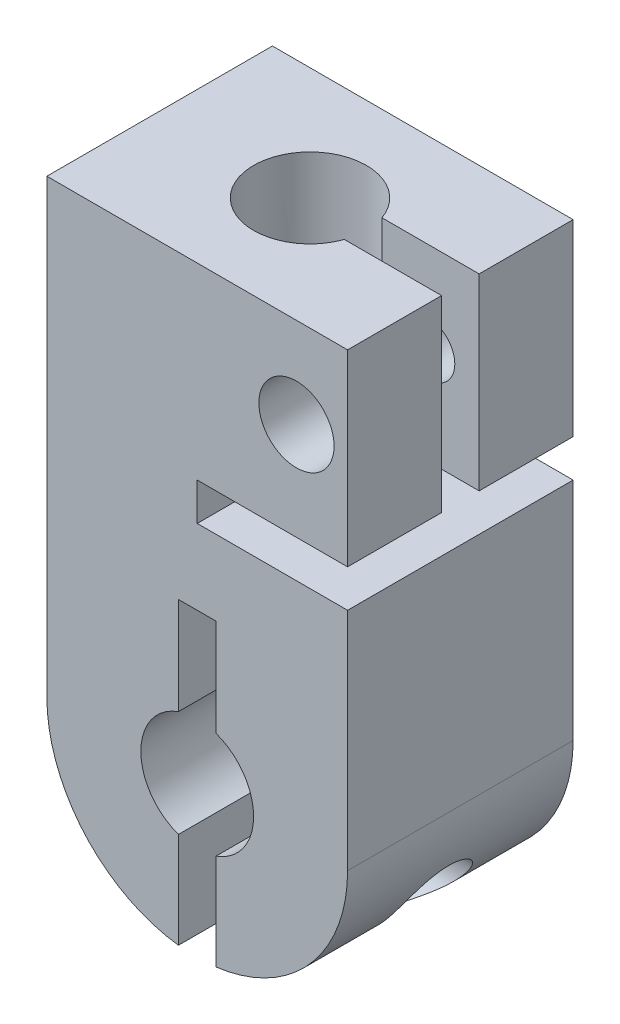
SolidWorks part; units mm, degrees
ref_plane "Front" through (0, 0, 0) normal (0, 0, 1) x (1, 0, 0)
ref_plane "Top" through (0, 0, 0) normal (0, 1, 0) x (1, 0, 0)
ref_plane "Right" through (0, 0, 0) normal (1, 0, 0) x (0, 0, -1)
sketch "Sketch1" plane through (0, 0, 0) normal (0, 0, 1) x (1, 0, 0)
  line L0 (-6.35, 0) -> (-6.35, 19.05)
  line L1 (-6.35, 19.05) -> (6.35, 19.05)
  line L2 (6.35, 19.05) -> (6.35, 0)
  line L3 (0, 1.0741) -> (0, 0) construction
  line L4 (0, 0) -> (0, 19.05) construction
  circle A0 centre (0, 0) radius 2.3813
  arc A1 (-6.35, 0) -> (6.35, 0) centre (0, 0) ccw
  dimension "D1" = 4.7625
  dimension "D3" = 19.05
  dimension "D2" = 12.7
extrude "Extrude1" add sketch "Sketch1" along normal blind 9.525
sketch "Sketch2" plane through (0, 0, 9.525) normal (0, 0, 1) x (1, 0, 0)
  line L0 (0, 0) -> (0, -7.0537) construction
  line L2 (-0.7938, 6.35) -> (0.7937, 6.35)
  line L3 (-0.7938, 6.35) -> (-0.7938, -10.2201)
  line L4 (-0.7938, -10.2201) -> (0.7938, -10.2201)
  line L5 (0.7937, 6.35) -> (0.7938, -10.2201)
  dimension "D1" = 1.5875
  dimension "D2" = 6.35
extrude "Cut-Extrude1" cut sketch "Sketch2" against normal through all
hole_wizard "#4-40 Tapped Hole1" positions "Sketch4" profile "Sketch3" tap size "#4-40" standard "Ansi Inch"
sketch "Sketch4" plane through (-0.7938, 0, 0) normal (1, 0, 0) x (0, 0, -1)
  line L0 (-4.7625, -6.3002) -> (-4.7625, 0.5343) construction
  line L1 (0, -6.3002) -> (-9.525, -6.3002) construction
  line L2 (-4.7625, 0.5343) -> (3.2388, 13.129) construction
  point P9 (-4.7625, -4.064)
  dimension "D2" = 4.064
sketch "Sketch3" plane through (-0.7938, -4.064, 4.7625) normal (0, 1, 0) x (0, 0, -1)
  line L0 (0, 0) -> (0, 5.5562)
  line L1 (0, 5.5562) -> (1.1303, 5.5562)
  line L2 (1.1303, 5.5562) -> (1.1303, 0)
  line L5 (1.1303, 0) -> (0, 0)
  line L11 (0, -6.35) -> (0, 107.95) construction
  dimension "Thru Tap Drill Dia." = 2.2606
  dimension "Thru Tap Drill Depth" = 5.5562
hole_wizard "#4 Clearance Hole1" positions "Sketch8" profile "Sketch7" hole size "#4" standard "Ansi Inch"
sketch "Sketch8" plane through (0.7937, 0, 0) normal (-1, 0, 0) x (0, 0, 1)
  point P0 (4.7625, -4.064)
sketch "Sketch7" plane through (0.7938, -4.064, 4.7625) normal (0, 1, 0) x (0, 0, 1)
  line L0 (0, 0) -> (0, 5.5563)
  line L1 (0, 5.5563) -> (1.6319, 5.5563)
  line L2 (1.6319, 5.5563) -> (1.6319, 0)
  line L5 (1.6319, 0) -> (0, 0)
  line L11 (0, -6.35) -> (0, 107.95) construction
  dimension "Thru Hole Dia." = 3.2639
  dimension "Thru Hole Depth" = 5.5563
sketch "Sketch11" plane through (0, 19.05, 0) normal (0, 1, 0) x (-1, 0, 0)
  line L0 (-6.35, 4.7625) -> (0, 4.7625) construction
  line L1 (-6.35, 9.525) -> (-6.35, 0) construction
  line L2 (0, 4.7625) -> (0, 0) construction
  line L4 (-6.35, 3.9688) -> (-2.2451, 3.9688)
  line L5 (-6.35, 3.9688) -> (-6.35, 5.5563)
  line L6 (-6.35, 5.5563) -> (-2.2451, 5.5563)
  arc A0 (-2.2451, 3.9688) -> (-2.2451, 5.5563) centre (0, 4.7625) ccw
  dimension "D2" = 4.7625
  dimension "D1" = 1.5875
extrude "Cut-Extrude2" cut sketch "Sketch11" against normal blind 9.525
sketch "Sketch12" plane through (0, 0, 0) normal (0, 0, -1) x (-1, 0, 0)
  line L0 (-6.35, 0) -> (-6.35, 19.05) construction
  line L1 (-6.35, 9.525) -> (0, 9.525)
  line L2 (-6.35, 9.525) -> (-6.35, 11.1125)
  line L3 (-6.35, 11.1125) -> (0, 11.1125)
  line L4 (0, 9.525) -> (0, 11.1125)
  dimension "D1" = 6.35
  dimension "D2" = 1.5875
extrude "Cut-Extrude3" cut sketch "Sketch12" against normal through all
hole_wizard "#4-40 Tapped Hole3" positions "Sketch14" profile "Sketch13" tap size "#4-40" standard "Ansi Inch"
sketch "Sketch14" plane through (0, 0, 9.525) normal (0, 0, 1) x (1, 0, 0)
  line L0 (6.35, 19.05) -> (-6.35, 19.05) construction
  point P0 (4.191, 15.24)
  dimension "D1" = 4.191
  dimension "D2" = 3.81
sketch "Sketch13" plane through (4.191, 15.24, 9.525) normal (1, 0, 0) x (0, -1, 0)
  line L0 (0, 0) -> (0, 9.525)
  line L1 (0, 9.525) -> (1.1303, 9.525)
  line L2 (1.1303, 9.525) -> (1.1303, 0)
  line L5 (1.1303, 0) -> (0, 0)
  line L11 (0, -6.35) -> (0, 107.95) construction
  dimension "Thru Tap Drill Dia." = 2.2606
  dimension "Thru Tap Drill Depth" = 9.525
sketch "Sketch15" plane through (0, 0, 9.525) normal (0, 0, 1) x (1, 0, 0)
  circle A0 centre (4.191, 15.24) radius 1.5875
  dimension "D1" = 3.175
extrude "Cut-Extrude4" cut sketch "Sketch15" against normal up to next
